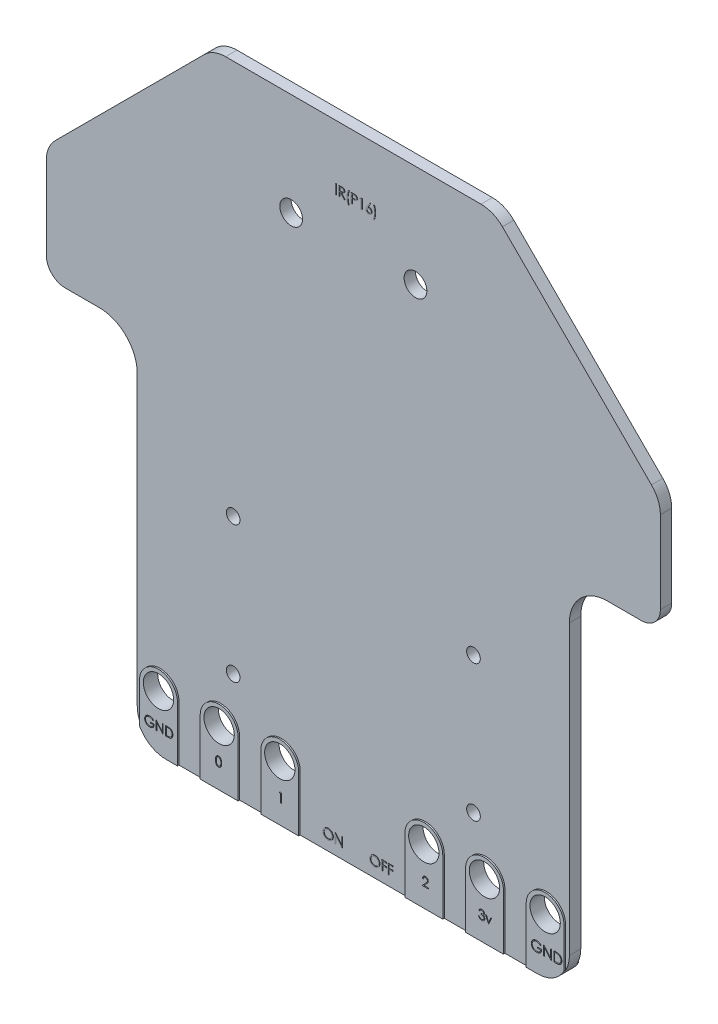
SolidWorks part; units mm, degrees
ref_plane "Plan de face" through (0, 0, 0) normal (0, 0, 1) x (1, 0, 0)
ref_plane "Plan de dessus" through (0, 0, 0) normal (0, 1, 0) x (1, 0, 0)
ref_plane "Plan de droite" through (0, 0, 0) normal (1, 0, 0) x (0, 0, -1)
sketch "Esquisse1" plane through (0, 0, 0) normal (0, 0, 1) x (1, 0, 0)
  line L0 (45.0086, 0) -> (45.0086, 84) construction
  line L1 (20.5086, 0) -> (69.5086, 0)
  line L2 (85.5086, 49.5) -> (85.5086, 60.3431)
  line L3 (28.1655, 84) -> (61.8518, 84)
  line L4 (84.3371, 63.1716) -> (64.6802, 82.8284)
  line L5 (73.5086, 4) -> (73.5086, 42)
  line L6 (78.5086, 47) -> (83.0086, 47)
  line L7 (11.5086, 47) -> (7.0086, 47)
  line L8 (16.5086, 4) -> (16.5086, 42)
  line L9 (5.6802, 63.1716) -> (25.3371, 82.8284)
  line L10 (4.5086, 49.5) -> (4.5086, 60.3431)
  line L11 (32.2035, 70.5) -> (61.8518, 70.5) construction
  line L12 (60.8586, 0) -> (60.8586, 40.2487) construction
  line L13 (53.2086, 23) -> (66.4919, 23) construction
  line L14 (18.0669, 7.3) -> (68.062, 7.3) construction
  arc A0 (73.5086, 4) -> (69.5086, 0) centre (69.5086, 4) cw
  arc A1 (78.5086, 47) -> (73.5086, 42) centre (78.5086, 42) ccw
  arc A2 (85.5086, 49.5) -> (83.0086, 47) centre (83.0086, 49.5) cw
  arc A3 (64.6802, 82.8284) -> (61.8518, 84) centre (61.8518, 80) ccw
  arc A4 (85.5086, 60.3431) -> (84.3371, 63.1716) centre (81.5086, 60.3431) ccw
  arc A5 (4.5086, 60.3431) -> (5.6802, 63.1716) centre (8.5086, 60.3431) cw
  arc A6 (25.3371, 82.8284) -> (28.1655, 84) centre (28.1655, 80) cw
  arc A7 (4.5086, 49.5) -> (7.0086, 47) centre (7.0086, 49.5) ccw
  arc A8 (11.5086, 47) -> (16.5086, 42) centre (11.5086, 42) cw
  arc A9 (16.5086, 4) -> (20.5086, 0) centre (20.5086, 4) ccw
  circle A10 centre (53.2086, 70.5) radius 1.5
  circle A11 centre (36.8086, 70.5) radius 1.5
  circle A12 centre (60.8586, 14) radius 0.9
  circle A13 centre (60.8586, 32) radius 0.9
  circle A14 centre (29.1586, 14) radius 0.9
  circle A15 centre (29.1586, 32) radius 0.9
  circle A16 centre (19.5086, 7.3) radius 2
  circle A17 centre (27.5086, 7.3) radius 2
  circle A18 centre (35.5086, 7.3) radius 2
  circle A19 centre (70.5086, 7.3) radius 2
  circle A20 centre (62.5086, 7.3) radius 2
  circle A21 centre (54.5086, 7.3) radius 2
  point P18 (85.5086, 62)
  dimension "D1" = 4
  dimension "D2" = 5
  dimension "D5" = 2.5
  dimension "D6" = 4
  dimension "D10" = 3
  dimension "D14" = 9
  dimension "D16" = 3
  dimension "D17" = 3
  dimension "D3" = 84
  dimension "D4" = 28.5
  dimension "D7" = 15
  dimension "D8" = 13.5
  dimension "D9" = 40.5
  dimension "D11" = 8.2
  dimension "D12" = 12.65
  dimension "D13" = 23
  dimension "D15" = 7.3
extrude "Extrusion1" add sketch "Esquisse1" along normal blind 1.5
sketch "Esquisse2" plane through (0, 0, 1.5) normal (0, 0, 1) x (1, 0, 0)
  line L0 (22.0086, 7.3) -> (22.0086, 0)
  line L1 (20.5086, 0) -> (69.5086, 0) construction
  line L2 (17.0086, 7.3) -> (17.0086, 2.0635)
  line L3 (22.0086, 0) -> (20.5086, 0)
  line L4 (25.0086, 7.3) -> (25.0086, 0)
  line L5 (25.0086, 0) -> (30.0086, 0)
  line L6 (30.0086, 0) -> (30.0086, 7.3)
  line L7 (33.0086, 7.3) -> (33.0086, 0)
  line L8 (33.0086, 0) -> (38.0086, 0)
  line L9 (38.0086, 0) -> (38.0086, 7.3)
  line L10 (45.0086, 0) -> (45.0086, 18.2451) construction
  line L11 (52.0086, 0) -> (52.0086, 7.3)
  line L12 (57.0086, 0) -> (52.0086, 0)
  line L13 (57.0086, 7.3) -> (57.0086, 0)
  line L14 (60.0086, 0) -> (60.0086, 7.3)
  line L15 (65.0086, 0) -> (60.0086, 0)
  line L16 (65.0086, 7.3) -> (65.0086, 0)
  line L17 (68.0086, 0) -> (69.5086, 0)
  line L18 (73.0086, 7.3) -> (73.0086, 2.0635)
  line L19 (68.0086, 7.3) -> (68.0086, 0)
  circle A0 centre (19.5086, 7.3) radius 2
  arc A1 (16.5086, 4) -> (20.5086, 0) centre (20.5086, 4) ccw construction
  arc A2 (17.0086, 2.0635) -> (20.5086, 0) centre (20.5086, 4) ccw
  arc A3 (22.0086, 7.3) -> (17.0086, 7.3) centre (19.5086, 7.3) ccw
  arc A4 (30.0086, 7.3) -> (25.0086, 7.3) centre (27.5086, 7.3) ccw
  arc A5 (38.0086, 7.3) -> (33.0086, 7.3) centre (35.5086, 7.3) ccw
  circle A6 centre (27.5086, 7.3) radius 2
  circle A7 centre (35.5086, 7.3) radius 2
  circle A8 centre (54.5086, 7.3) radius 2
  circle A9 centre (62.5086, 7.3) radius 2
  arc A10 (52.0086, 7.3) -> (57.0086, 7.3) centre (54.5086, 7.3) cw
  arc A11 (60.0086, 7.3) -> (65.0086, 7.3) centre (62.5086, 7.3) cw
  arc A12 (68.0086, 7.3) -> (73.0086, 7.3) centre (70.5086, 7.3) cw
  arc A13 (73.0086, 2.0635) -> (69.5086, 0) centre (69.5086, 4) cw
  circle A14 centre (70.5086, 7.3) radius 2
extrude "Extrusion2" add sketch "Esquisse2" along normal blind 0.2
sketch "Esquisse3" plane through (0, 0, 1.7) normal (0, 0, 1) x (1, 0, 0)
  line L0 (45.0086, 0) -> (45.0086, 16.2348) construction
  line L1 (38.0086, 0) -> (52.0086, 0) construction
  line L2 (17.5973, 2.6564) -> (68.585, 2.4316) construction
  text T0 "GND" font "Century Gothic" height 1.2
  text T1 "GND" font "Century Gothic" height 1.3
  text T2 "1" font "Century Gothic" height 1.2
  text T3 "0" font "Century Gothic" height 1.2
  text T4 "2" font "Century Gothic" height 1.2
  text T5 "3v" font "Century Gothic" height 1.2
extrude "Enlèv. mat.-Extru.1" cut sketch "Esquisse3" against normal blind 0.2
ref_plane "Plan1" through (0, 0, 0.75) normal (0, 0, 1) x (1, 0, 0)
mirror "Symétrie2" about plane through (0, 0, 0.75) normal (0, 0, 1) of "Extrusion2"
sketch "Esquisse4" plane through (0, 0, 1.5) normal (0, 0, 1) x (1, 0, 0)
  text T0 "ON       OFF" font "Century Gothic" height 1.25
  text T1 "IR(P16)" font "Century Gothic" height 1.25
extrude "Extrusion3" add sketch "Esquisse4" along normal blind 0.05
